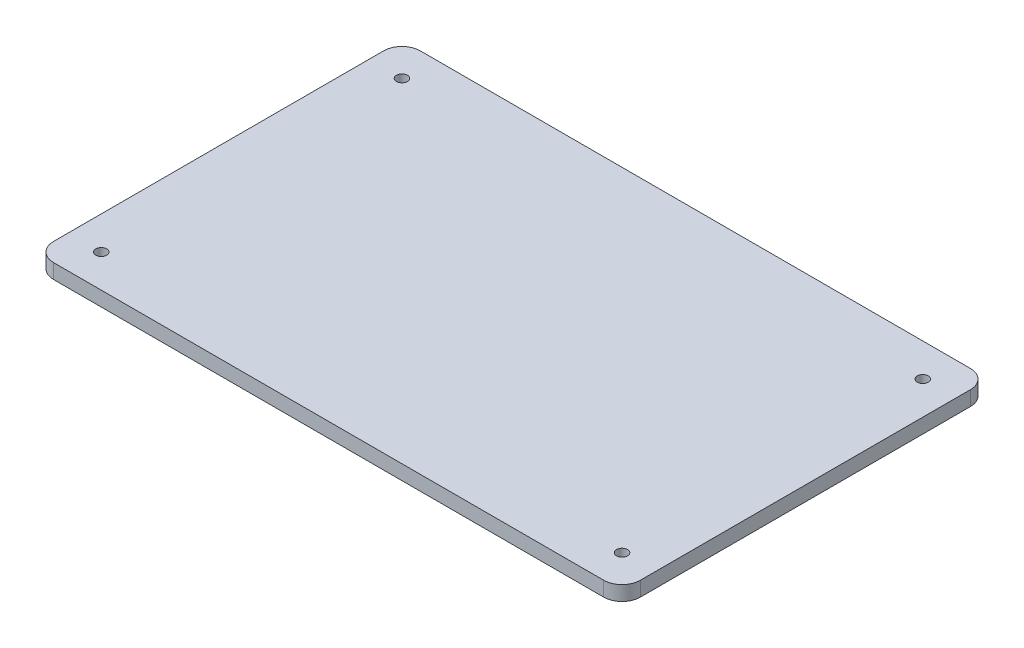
SolidWorks part; units mm, degrees
ref_plane "Ebene vorne" through (0, 0, 0) normal (0, 0, 1) x (1, 0, 0)
ref_plane "Ebene oben" through (0, 0, 0) normal (0, 1, 0) x (1, 0, 0)
ref_plane "Ebene rechts" through (0, 0, 0) normal (1, 0, 0) x (0, 0, -1)
sketch "Skizze2" plane through (0, 0, 0) normal (0, 1, 0) x (1, 0, 0)
  line L1 (0, 0) -> (160, 0)
  line L2 (0, 0) -> (0, -100)
  line L3 (0, -100) -> (160, -100)
  line L4 (160, 0) -> (160, -100)
  dimension "D1" = 160
  dimension "D2" = 100
extrude "Aufsatz-Linear austragen1" add sketch "Skizze2" along normal blind 4
sketch "Skizze3" plane through (0, 4, 0) normal (0, 1, 0) x (1, 0, 0)
  line L0 (0, -100) -> (160, -100) construction
  line L1 (0, 0) -> (0, -100) construction
  line L2 (0, -50) -> (160, -50) construction
  line L3 (160, -100) -> (160, 0) construction
  line L4 (160, 0) -> (0, 0) construction
  line L5 (80, -100) -> (80, 0) construction
  circle A0 centre (9, -91) radius 1.5
  circle A1 centre (9, -9) radius 1.5
  circle A2 centre (151, -91) radius 1.5
  circle A3 centre (151, -9) radius 1.5
  dimension "D1" = 3
  dimension "D2" = 9
  dimension "D3" = 9
extrude "Schnitt-Linear austragen1" cut sketch "Skizze3" against normal through all
fillet "Verrundung1" radius 5 1 edges at (0, 2, 100)
fillet "Verrundung3" radius 5 1 edges at (160, 2, 0)
fillet "Verrundung4" radius 5 1 edges at (0, 2, 0)
fillet "Verrundung6" radius 5 1 edges at (160, 2, 100)
